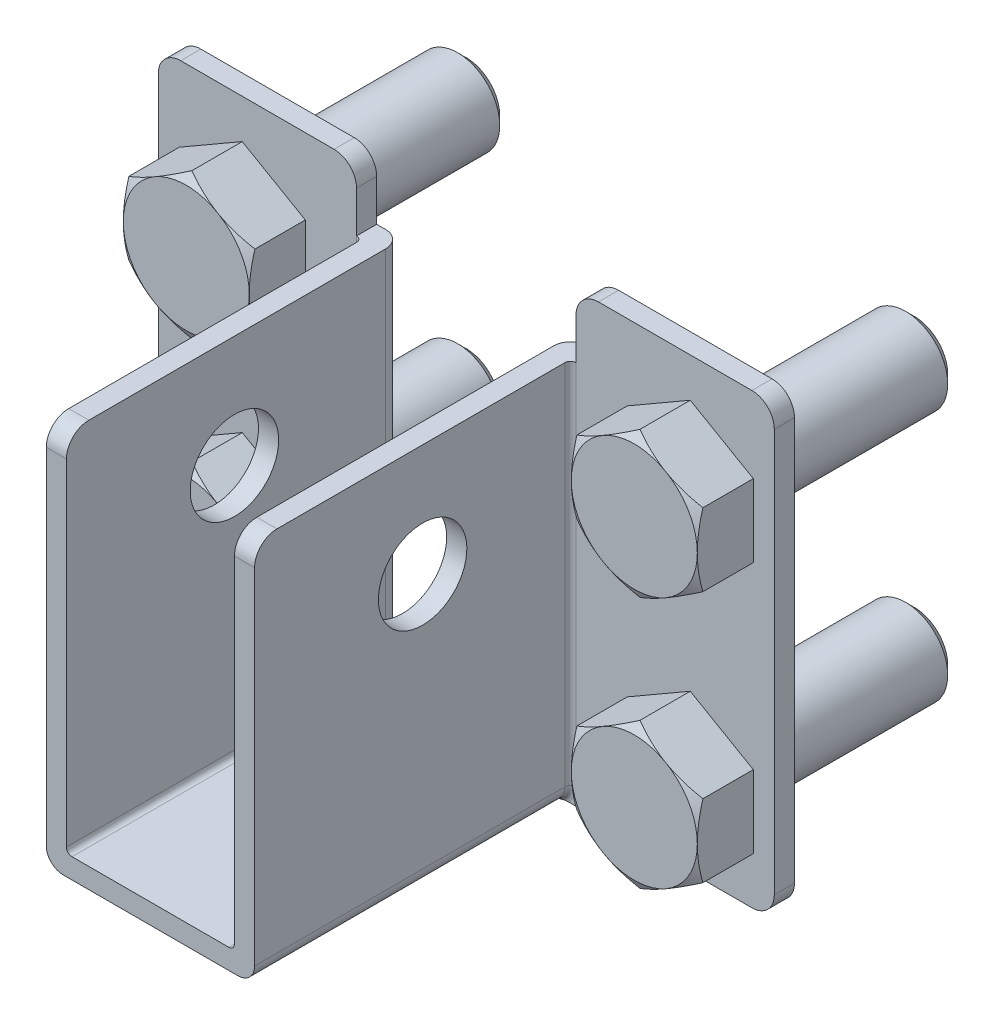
SolidWorks part; units mm, degrees
other "<3.2-1>-<Cut-Extrude3>"
other "<3.2-1>-<Cut-Extrude3>"
other "<3.2-1>-<Cut-Extrude3>"
other "<3.2-1>-<Cut-Extrude3>" parameters "D1"=36.4693, "D2"=1.27, "Nose Ht (Stock Check)"=38.1, "Thickness (Stock Check)"=2.286, "Hole Spacing 3 (Stock Check)"=28.575, "D3"=38.1, "Hole Spacing 4 (Stock Check)"=19.05, "Hole Size"=10.033, "Hole Spacing 1 (Stock Check)"=50.8, "Hole Spacing 2 (Stock Check)"=28.575, "D4"=11.9776, "Hole Offset (Stock Check)"=12.7
ref_plane "Front" through (0, 0, 0) normal (0, 0, 1) x (1, 0, 0)
ref_plane "Top" through (0, 0, 0) normal (0, 1, 0) x (1, 0, 0)
ref_plane "Right" through (0, 0, 0) normal (1, 0, 0) x (0, 0, -1)
sketch "Sketch1" plane through (0, 0, 0) normal (0, 0, 1) x (1, 0, 0)
  line L0 (-9.525, 0) -> (9.525, 0) construction
  line L1 (9.525, 50.8) -> (34.925, 50.8)
  line L2 (9.525, 50.8) -> (9.525, 0)
  line L3 (9.525, 0) -> (34.925, 0)
  line L4 (34.925, 50.8) -> (34.925, 0)
  line L5 (-34.925, 50.8) -> (-9.525, 50.8)
  line L6 (-34.925, 50.8) -> (-34.925, 0)
  line L7 (-34.925, 0) -> (-9.525, 0)
  line L8 (-9.525, 50.8) -> (-9.525, 0)
  dimension "Max Panel Thickness" = 19.05
  dimension "C" = 69.85
  dimension "B" = 50.8
extrude "Boss-Extrude1" add sketch "Sketch1" along normal blind 2.286
sketch "Sketch3" plane through (0, 0, 0) normal (0, 0, 1) x (1, 0, 0)
  line L0 (-9.525, 2.286) -> (9.525, 2.286)
  line L1 (-11.811, 43.561) -> (-9.525, 43.561)
  line L2 (-11.811, 43.561) -> (-11.811, 0)
  line L3 (-9.525, 0) -> (-9.525, 50.8) construction
  line L4 (-9.525, 43.561) -> (-9.525, 2.286)
  line L5 (9.525, 43.561) -> (11.811, 43.561)
  line L6 (9.525, 43.561) -> (9.525, 2.286)
  line L7 (9.525, 50.8) -> (9.525, 0) construction
  line L8 (11.811, 43.561) -> (11.811, 0)
  line L9 (0, 0) -> (0, 2.286) construction
  line L11 (-11.811, 0) -> (11.811, 0)
extrude "Boss-Extrude2" add sketch "Sketch3" along normal blind 38.1
fillet "Fillet3" radius 1.905 4 edges at (11.811, 0, 20.193) (-11.811, 0, 20.193) (9.525, 26.543, 0) (-9.525, 26.543, 0)
fillet "Fillet2" radius 0.635 8 edges at (-9.525, 2.286, 20.0025) (9.525, 2.286, 20.0025) (-11.811, 22.733, 2.286) (11.811, 22.733, 2.286) (-11.253, 0.558, 2.286) (11.253, 0.558, 2.286) (-10.083, 2.286, 0.558) (10.083, 2.286, 0.558)
sketch "Sketch5" plane through (0, 0, 0) normal (0, 0, 1) x (1, 0, 0)
  line L0 (34.925, 50.8) -> (9.525, 50.8) construction
  line L1 (-12.446, 43.561) -> (12.446, 43.561)
  line L2 (-12.446, 43.561) -> (-12.446, 50.8)
  line L3 (-12.446, 50.8) -> (12.446, 50.8)
  line L4 (12.446, 43.561) -> (12.446, 50.8)
extrude "Cut-Extrude4" cut sketch "Sketch5" along normal through all
fillet "Fillet4" radius 2.54 8 edges at (34.925, 0, 1.143) (10.668, 43.561, 38.1) (-10.668, 43.561, 38.1) (-34.925, 0, 1.143) (34.925, 50.8, 1.143) (12.446, 50.8, 1.143) (-12.446, 50.8, 1.143) (-34.925, 50.8, 1.143)
sketch "Sketch6" plane through (0, 0, 0) normal (0, 0, 1) x (1, 0, 0)
  line L0 (-14.986, 50.8) -> (-32.385, 50.8) construction
  line L1 (-25.4, 38.1) -> (25.4, 38.1) construction
  line L2 (-25.4, 38.1) -> (-25.4, 9.525) construction
  line L3 (-25.4, 9.525) -> (25.4, 9.525) construction
  line L4 (25.4, 38.1) -> (25.4, 9.525) construction
  circle A0 centre (-25.4, 38.1) radius 5.0165
  circle A1 centre (25.4, 38.1) radius 5.0165
  circle A2 centre (25.4, 9.525) radius 5.0165
  circle A3 centre (-25.4, 9.525) radius 5.0165
  point P10 (0, 38.1)
extrude "Cut-Extrude5" cut sketch "Sketch6" along normal through all
sketch "Sketch7" plane through (0, 0, 0) normal (1, 0, 0) x (0, 0, -1)
  line L0 (-1.905, 2.286) -> (-38.1, 2.286) construction
  line L1 (-38.1, 1.905) -> (-38.1, 41.021) construction
  circle A0 centre (-19.05, 30.861) radius 5.0165
extrude "Cut-Extrude6" cut sketch "Sketch7" against normal through all and the other way through all
sketch "Sketch8" plane through (0, 0, 0) normal (0, 1, 0) x (1, 0, 0)
  line L0 (11.811, -14.0335) -> (9.525, -14.0335) construction
  line L1 (-9.525, -14.0335) -> (-11.811, -14.0335) construction
  line L2 (9.525, -24.0665) -> (11.811, -24.0665) construction
  line L3 (-11.811, -24.0665) -> (-9.525, -24.0665) construction
  line L4 (11.811, -14.0335) -> (9.525, -14.0335)
  line L5 (-9.525, -14.0335) -> (-11.811, -14.0335)
  line L6 (9.525, -24.0665) -> (11.811, -24.0665)
  line L7 (-11.811, -24.0665) -> (-9.525, -24.0665)
  line L8 (-12.827, -19.05) -> (-8.509, -19.05) construction
  line L9 (9.525, -19.05) -> (11.811, -19.05) construction
  line L10 (8.509, -19.05) -> (12.827, -19.05) construction
  line L11 (9.525, -1.905) -> (9.525, -38.1) construction
  line L12 (11.811, -35.56) -> (11.811, -2.921) construction
  line L13 (-11.811, -35.56) -> (-11.811, -2.921) construction
  dimension "D1" = 1.016
  dimension "D2" = 1.016
  dimension "D3" = 1.016
sketch "Sketch9" plane through (0, 0, 0) normal (0, 0, 1) x (1, 0, 0)
  line L0 (9.525, 25.8445) -> (11.811, 25.8445) construction
  line L1 (-11.811, 25.8445) -> (-9.525, 25.8445) construction
  line L2 (-9.525, 35.8775) -> (-11.811, 35.8775) construction
  line L3 (11.811, 35.8775) -> (9.525, 35.8775) construction
  line L4 (9.525, 25.8445) -> (11.811, 25.8445)
  line L5 (-11.811, 25.8445) -> (-9.525, 25.8445)
  line L6 (-9.525, 35.8775) -> (-11.811, 35.8775)
  line L7 (11.811, 35.8775) -> (9.525, 35.8775)
  line L8 (-12.827, 30.861) -> (-8.509, 30.861) construction
  line L9 (9.525, 30.861) -> (11.811, 30.861) construction
  line L10 (8.509, 30.861) -> (12.827, 30.861) construction
inserted part "3.2-1"
move or copy body "Body-Move/Copy2" placed by mates yes
inserted part "3.2-1"
move or copy body "Body-Move/Copy4" placed by mates yes
inserted part "3.2-11"
move or copy body "Body-Move/Copy6" placed by mates yes
inserted part "3.2-12"
move or copy body "Body-Move/Copy8" placed by mates yes
combine bodies "Combine1" operation type add bodies to combine 114 115 116 118
combine bodies "Combine2" operation type add bodies to combine 119 120
equation "\"D1@Sketch3\" = \"Thickness (Stock Check)@Boss-Extrude1\""
equation "\"D1@Sketch7\" = \"Hole Size@Sketch6\""
